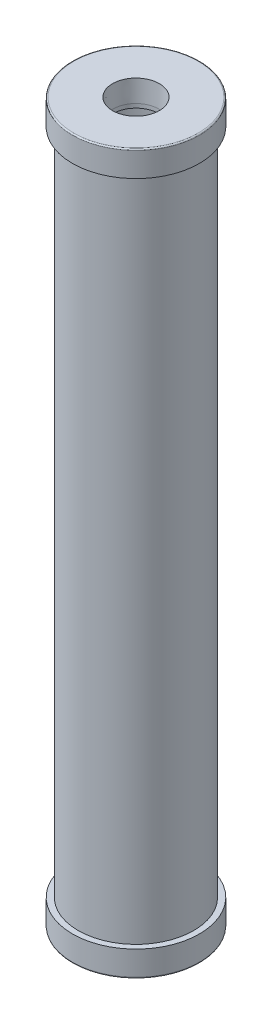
SolidWorks part; units mm, degrees
ref_plane "Front Plane" through (0, 0, 0) normal (0, 0, 1) x (1, 0, 0)
ref_plane "Top Plane" through (0, 0, 0) normal (0, 1, 0) x (1, 0, 0)
ref_plane "Right Plane" through (0, 0, 0) normal (1, 0, 0) x (0, 0, -1)
sketch "Sketch1" plane through (0, 0, 0) normal (0, 1, 0) x (1, 0, 0)
  circle A0 centre (0, 0) radius 57.15
  circle A1 centre (0, 0) radius 50.546
  dimension "D1" = 114.3
  dimension "D2" = 6.604
extrude "Boss-Extrude1" add sketch "Sketch1" along normal blind 711.2
sketch "Sketch2" plane through (0, 0, 0) normal (0, 1, 0) x (1, 0, 0)
  circle A0 centre (0, 0) radius 62.865
  dimension "D1" = 125.73
extrude "Boss-Extrude2" add sketch "Sketch2" along normal blind 25.4
hole_wizard "1-1/2 Rc Tapped Hole1" positions "Sketch4" profile "Sketch3" size "1-1/2" standard "BSI"
sketch "Sketch4" plane through (0, 0, 0) normal (0, 1, 0) x (1, 0, 0)
  point P0 (0, 0)
sketch "Sketch3" plane through (0, 0, 0) normal (1, 0, 0) x (0, 0, -1)
  line L0 (0, 0) -> (0, 46.3454)
  line L1 (22.6, 32.766) -> (0, 46.3454)
  line L2 (-22.6, 32.766) -> (0, 46.3454) construction
  line L3 (22.6, 32.766) -> (22.6, 21.336)
  line L4 (22.6, 21.336) -> (22.494, 21.336)
  line L5 (22.494, 21.336) -> (23.16, 0)
  line L6 (-22.494, 21.336) -> (-23.16, 0) construction
  line L7 (23.16, 0) -> (0, 0)
  line L8 (0, -6.35) -> (0, 107.95) construction
  line L11 (-22.6, 21.336) -> (-22.494, 21.336) construction
  dimension "Tap Drill Dia." = 45.2
  dimension "Tap Drill Depth" = 32.766
  dimension "Thread Dia." = 46.32
  dimension "Thread Angle" = 3.576
  dimension "Thread Depth" = 21.336
  dimension "Drill Angle" = 118
ref_plane "Plane1" through (0, 711.2, 0) normal (0, 1, 0) x (1, 0, 0)
sketch "Sketch5" plane through (0, 711.2, 0) normal (0, 1, 0) x (1, 0, 0)
  circle A0 centre (0, 0) radius 62.865
  dimension "D1" = 125.73
extrude "Boss-Extrude3" add sketch "Sketch5" against normal blind 25.4
hole_wizard "1-1/2 Rc Tapped Hole2" positions "Sketch7" profile "Sketch6" size "1-1/2" standard "BSI"
sketch "Sketch7" plane through (0, 711.2, 0) normal (0, 1, 0) x (1, 0, 0)
  point P0 (0, 0)
sketch "Sketch6" plane through (0, 711.2, 0) normal (1, 0, 0) x (0, 0, 1)
  line L0 (0, 0) -> (0, 46.3454)
  line L1 (22.6, 32.766) -> (0, 46.3454)
  line L2 (-22.6, 32.766) -> (0, 46.3454) construction
  line L3 (22.6, 32.766) -> (22.6, 21.336)
  line L4 (22.6, 21.336) -> (22.494, 21.336)
  line L5 (22.494, 21.336) -> (23.16, 0)
  line L6 (-22.494, 21.336) -> (-23.16, 0) construction
  line L7 (23.16, 0) -> (0, 0)
  line L8 (0, -6.35) -> (0, 107.95) construction
  line L11 (-22.6, 21.336) -> (-22.494, 21.336) construction
  dimension "Tap Drill Dia." = 45.2
  dimension "Tap Drill Depth" = 32.766
  dimension "Thread Dia." = 46.32
  dimension "Thread Angle" = 3.576
  dimension "Thread Depth" = 21.336
  dimension "Drill Angle" = 118
fillet "Fillet1" radius 1.27 2 edges at (0, 0, 62.865) (0, 711.2, 62.865)
